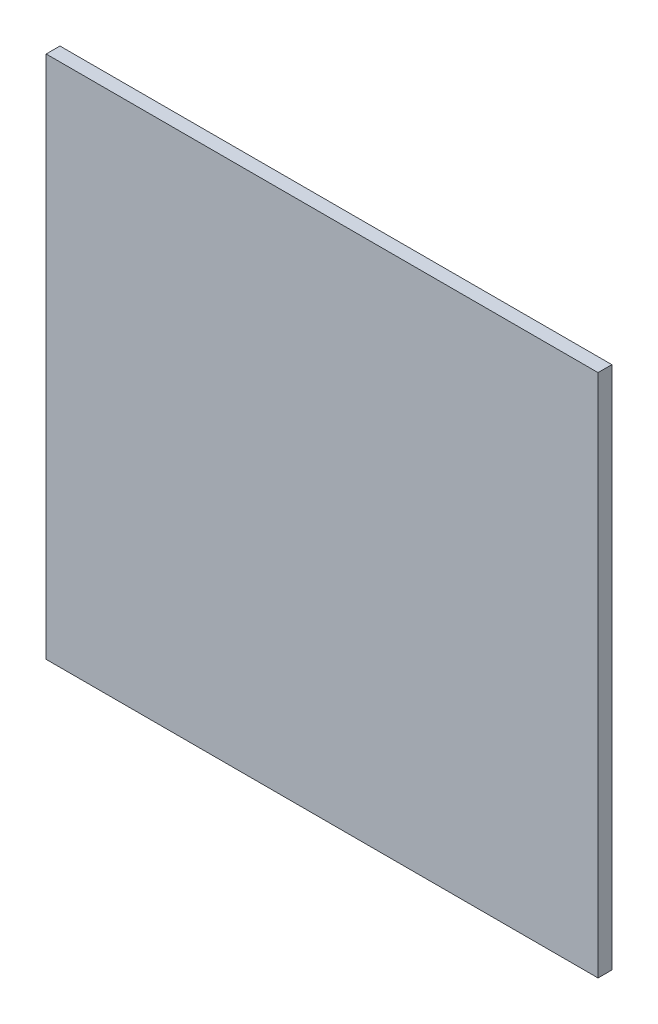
SolidWorks part; units mm, degrees
ref_plane "Alzado" through (0, 0, 0) normal (0, 0, 1) x (1, 0, 0)
ref_plane "Planta" through (0, 0, 0) normal (0, 1, 0) x (1, 0, 0)
ref_plane "Vista lateral" through (0, 0, 0) normal (1, 0, 0) x (0, 0, -1)
sketch "Croquis1" plane through (0, 0, 0) normal (0, 0, 1) x (1, 0, 0)
  line L1 (-300, 285) -> (300, 285)
  line L2 (-300, 285) -> (-300, -285)
  line L3 (-300, -285) -> (300, -285)
  line L4 (300, 285) -> (300, -285)
  line L5 (-300, 285) -> (300, -285) construction
  line L6 (-300, -285) -> (300, 285) construction
  point P0 (0, 0)
  dimension "D1" = 570
  dimension "D2" = 600
extrude "Saliente-Extruir3" add sketch "Croquis1" along normal blind 15
